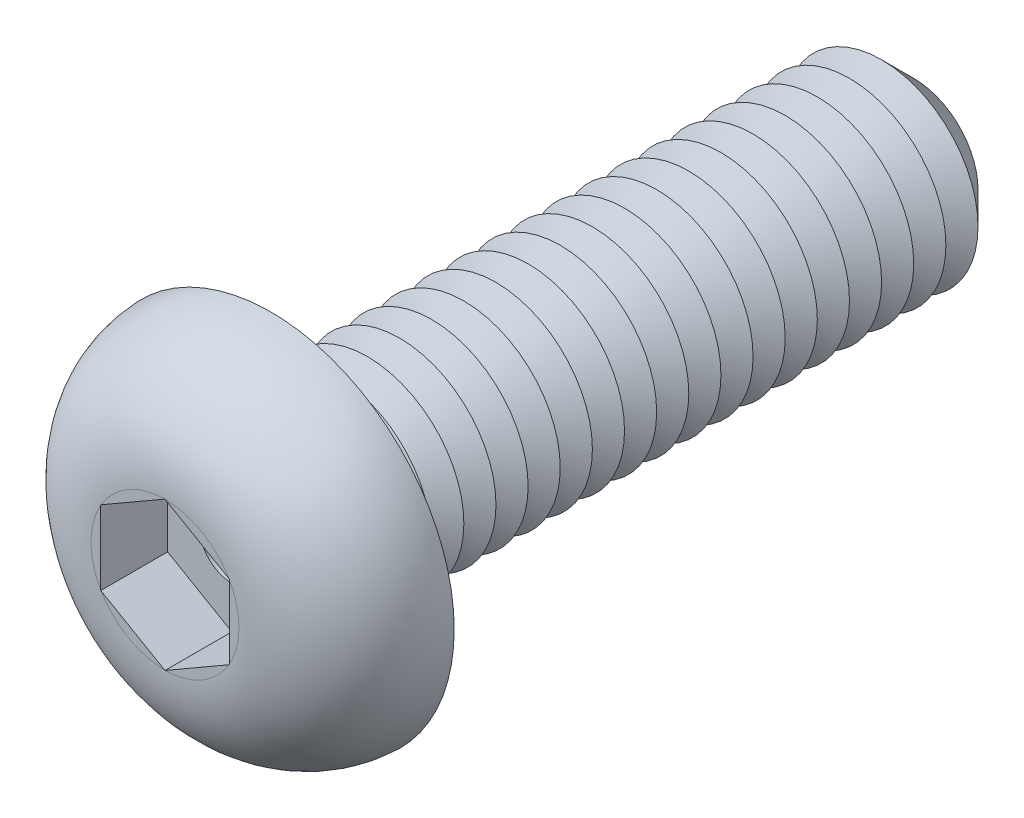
SolidWorks part; units mm, degrees
ref_plane "Front Plane" through (0, 0, 0) normal (0, 0, 1) x (1, 0, 0)
ref_plane "Top Plane" through (0, 0, 0) normal (0, 1, 0) x (1, 0, 0)
ref_plane "Right Plane" through (0, 0, 0) normal (1, 0, 0) x (0, 0, -1)
sketch "Sketch1" plane through (0, 0, 0) normal (1, 0, 0) x (0, 0, -1)
  line L0 (-47.9342, 0) -> (60.3146, 0) construction
sketch "Sketch2" plane through (0, 0, 0) normal (1, 0, 0) x (0, 0, -1)
  line L0 (0, 0) -> (-1.65, 0)
  line L1 (-47.9342, 0) -> (60.3146, 0) construction
  line L2 (-1.65, 0) -> (-1.65, 1.1507)
  line L3 (0, 2.85) -> (0, 0)
  arc A0 (-1.65, 1.1507) -> (0, 2.85) centre (0.05, 1.1507) cw
  dimension "D1" = 1.7
  dimension "D2" = 1.65
  dimension "D3" = 2.85
revolve "Revolve1" add sketch "Sketch2" angle 360 about L0
sketch "Sketch3" plane through (0, 0, 1.65) normal (0, 0, 1) x (1, 0, 0)
  line L1 (0, 1.1547) -> (-1, 0.5774)
  line L2 (-1, 0.5774) -> (-1, -0.5774)
  line L3 (-1, -0.5774) -> (0, -1.1547)
  line L4 (0, -1.1547) -> (1, -0.5774)
  line L5 (1, -0.5774) -> (1, 0.5774)
  line L6 (1, 0.5774) -> (0, 1.1547)
  circle A0 centre (0, 0) radius 1 construction
  dimension "D1" = 2
extrude "Cut-Extrude1" cut sketch "Sketch3" against normal blind 1.04
sketch "Sketch4" plane through (0, 0, 0) normal (0, 0, -1) x (-1, 0, 0)
  circle A0 centre (0, 0) radius 1.5
  dimension "D1" = 3
extrude "Boss-Extrude1" add sketch "Sketch4" along normal blind 10
chamfer "Chamfer1" distance 0.5 angle 45 1 edges at (-1.5, 0, -10)
sketch "Sketch5" plane through (0, 0, 0) normal (1, 0, 0) x (0, 0, -1)
  line L0 (0.5, 1.5) -> (1, 1.5)
  line L1 (9.5, 1.5) -> (0, 1.5) construction
  line L2 (1, 1.5) -> (0.75, 1.067)
  line L3 (0.75, 1.067) -> (0.5, 1.5)
  line L4 (0, -2.85) -> (0, 2.85) construction
  line L5 (9.5, 1.5) -> (0, 1.5) construction
  dimension "D1" = 0.5
  dimension "D2" = 0.5
revolve "Cut-Revolve1" cut sketch "Sketch5" angle 360 about L0
pattern_linear "LPattern1" count 18 spacing 0.5 along (0, 0, -1) of "Cut-Revolve1"
fillet "Fillet2" radius 0.25 1 edges at (1.5, 0, 0)
sketch "Sketch6" plane through (0, 0, 0.61) normal (0, 0, 1) x (1, 0, 0)
  circle A0 centre (0, 0) radius 0.5
  dimension "D1" = 1
extrude "Cut-Extrude2" cut sketch "Sketch6" against normal up to surface (10.61 mm away)
